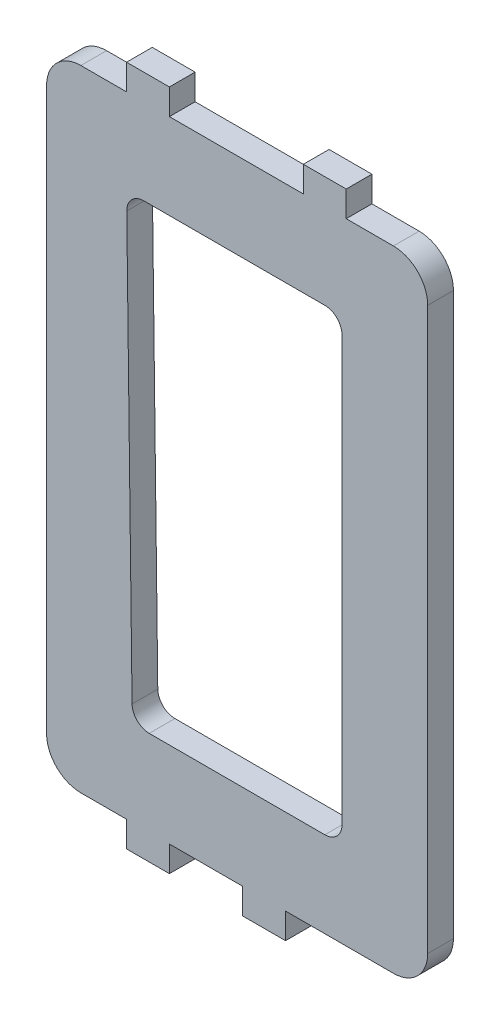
SolidWorks part; units mm, degrees
ref_plane "Alzado" through (0, 0, 0) normal (0, 0, 1) x (1, 0, 0)
ref_plane "Planta" through (0, 0, 0) normal (0, 1, 0) x (1, 0, 0)
ref_plane "Vista lateral" through (0, 0, 0) normal (1, 0, 0) x (0, 0, -1)
sketch "Croquis1" plane through (0, 0, 0) normal (0, 0, 1) x (1, 0, 0)
  line L0 (-27.7352, 52.6459) -> (-43.3652, 52.6459)
  line L1 (-48.3652, -20.8541) -> (-48.3652, -23.8541)
  line L2 (-48.3652, -23.8541) -> (-43.3652, -23.8541)
  line L3 (-43.3652, -23.8541) -> (-43.3652, -20.8541)
  line L4 (-34.8152, -23.8541) -> (-34.8152, -20.8541)
  line L5 (-34.8152, -20.8541) -> (-43.3652, -20.8541)
  line L6 (-57.6952, 48.6459) -> (-57.6952, -16.8541)
  line L8 (-34.8152, -23.8541) -> (-29.8152, -23.8541)
  line L9 (-29.8152, -23.8541) -> (-29.8152, -20.8541)
  line L10 (-29.8152, -20.8541) -> (-17.2252, -20.8541)
  line L12 (-27.7352, 55.6459) -> (-22.7352, 55.6459)
  line L13 (-48.3652, -20.8541) -> (-53.6952, -20.8541)
  line L14 (-13.2252, 48.6459) -> (-13.2252, -16.8541)
  line L16 (-22.7352, 55.6459) -> (-22.7352, 52.6459)
  line L17 (-27.7352, 55.6459) -> (-27.7352, 52.6459)
  line L18 (-22.7352, 52.6459) -> (-17.2252, 52.6459)
  line L20 (-35.5502, 42.6459) -> (-25.2252, 42.6459)
  line L21 (-23.2252, 40.6459) -> (-23.2252, -8.8541)
  line L22 (-25.2252, -10.8541) -> (-45.7201, -10.8541)
  line L23 (-47.7199, -8.8792) -> (-48.3399, 40.6208)
  line L24 (-46.34, 42.6459) -> (-35.5502, 42.6459)
  line L27 (-53.6952, 52.6459) -> (-48.3652, 52.6459)
  line L28 (-48.3652, 52.6459) -> (-48.3652, 55.6459)
  line L29 (-48.3652, 55.6459) -> (-43.3652, 55.6459)
  line L30 (-43.3652, 55.6459) -> (-43.3652, 52.6459)
  arc A0 (-53.6952, -20.8541) -> (-57.6952, -16.8541) centre (-53.6952, -16.8541) cw
  arc A1 (-13.2252, -16.8541) -> (-17.2252, -20.8541) centre (-17.2252, -16.8541) cw
  arc A2 (-17.2252, 52.6459) -> (-13.2252, 48.6459) centre (-17.2252, 48.6459) cw
  arc A3 (-57.6952, 48.6459) -> (-53.6952, 52.6459) centre (-53.6952, 48.6459) cw
  arc A4 (-23.2252, -8.8541) -> (-25.2252, -10.8541) centre (-25.2252, -8.8541) cw
  arc A5 (-25.2252, 42.6459) -> (-23.2252, 40.6459) centre (-25.2252, 40.6459) cw
  arc A6 (-48.3399, 40.6208) -> (-46.34, 42.6459) centre (-46.34, 40.6459) cw
  arc A7 (-45.7201, -10.8541) -> (-47.7199, -8.8792) centre (-45.7201, -8.8541) cw
  point P47 (-8.5252, 49.1459)
  dimension "D1" = 4
  dimension "D2" = 2
extrude "Saliente-Extruir1" add sketch "Croquis1" along normal blind 3
